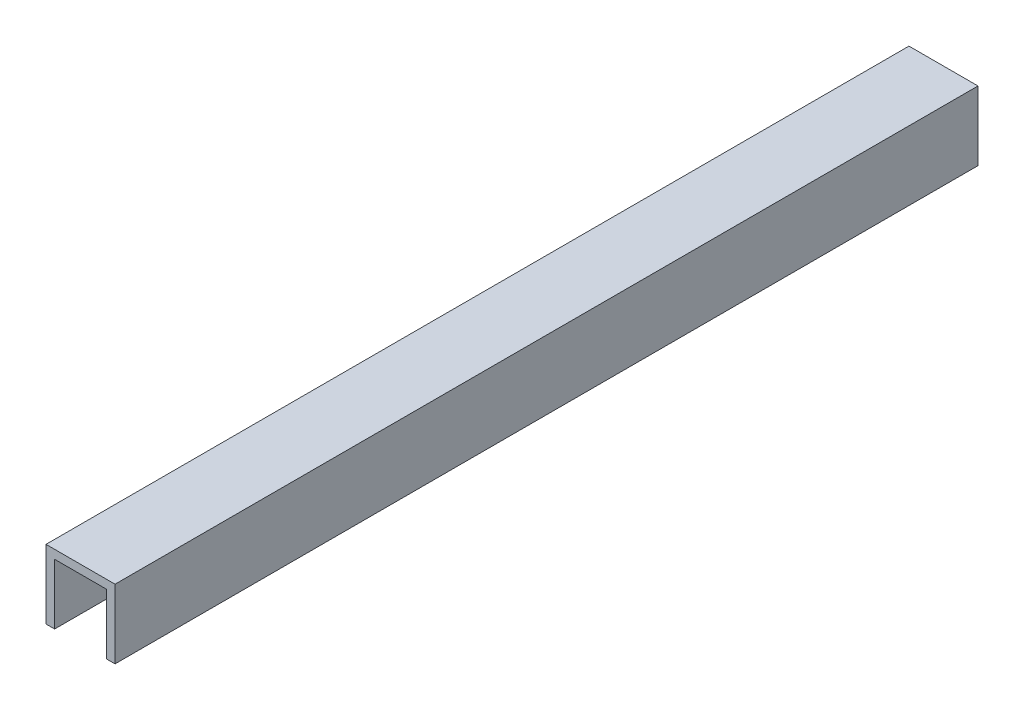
SolidWorks part; units mm, degrees
ref_plane "Ebene vorne" through (0, 0, 0) normal (0, 0, 1) x (1, 0, 0)
ref_plane "Ebene oben" through (0, 0, 0) normal (0, 1, 0) x (1, 0, 0)
ref_plane "Ebene rechts" through (0, 0, 0) normal (1, 0, 0) x (0, 0, -1)
sketch "Skizze1" plane through (0, 0, 0) normal (0, 0, 1) x (1, 0, 0)
  line L1 (4, -4) -> (-4, -4)
  line L2 (4, -4) -> (4, 4)
  line L3 (4, 4) -> (-4, 4)
  line L4 (-4, -4) -> (-4, 4)
  line L5 (4, -4) -> (-4, 4) construction
  line L6 (4, 4) -> (-4, -4) construction
  point P0 (0, 0)
  dimension "D1" = 8
extrude "Aufsatz-Linear austragen1" add sketch "Skizze1" along normal mid plane 100 contours L3 L4 L1 L2
shell "Wandung1" thickness 1
